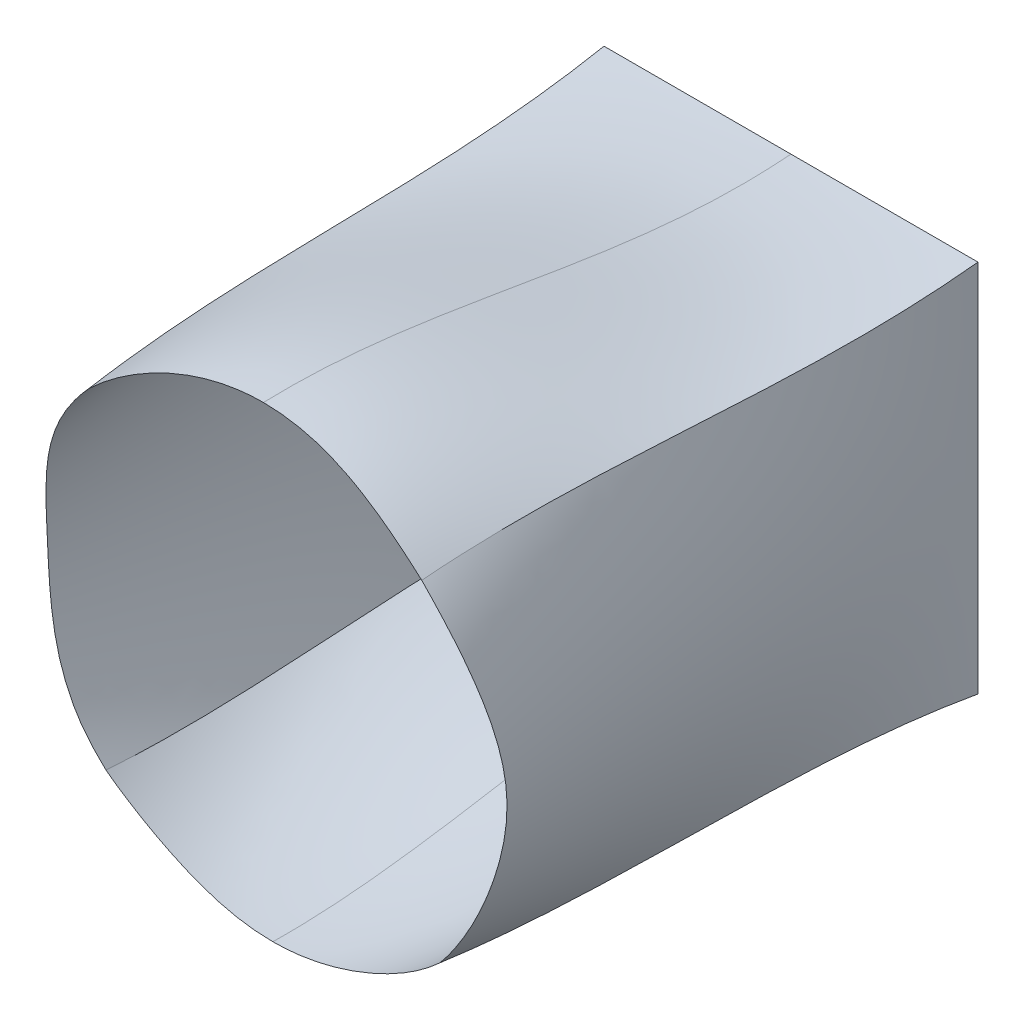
SolidWorks part; units mm, degrees
ref_plane "Front Plane" through (0, 0, 0) normal (0, 0, 1) x (1, 0, 0)
ref_plane "Top Plane" through (0, 0, 0) normal (0, 1, 0) x (1, 0, 0)
ref_plane "Right Plane" through (0, 0, 0) normal (1, 0, 0) x (0, 0, -1)
sketch "Sketch1" plane through (0, 0, 0) normal (0, 0, 1) x (1, 0, 0)
  line L1 (-50, 50) -> (50, 50)
  line L2 (-50, 50) -> (-50, -50)
  line L3 (-50, -50) -> (50, -50)
  line L4 (50, 50) -> (50, -50)
  line L5 (-50, 50) -> (50, -50) construction
  line L6 (-50, -50) -> (50, 50) construction
  point P0 (0, 0)
  dimension "D1" = 100
ref_plane "Plane2" through (0, 0, 150) normal (0, 0, 1) x (1, 0, 0)
sketch "Sketch2" plane through (0, 0, 150) normal (0, 0, 1) x (1, 0, 0)
  line L0 (-50, 50) -> (50, -50) construction
  circle A0 centre (0, 0) radius 62.5
  dimension "D1" = 125
sketch "Sketch3" plane through (0, 0, 0) normal (1, 0, 0) x (0, 0, -1)
  line L4 (0, 0) -> (-36.5278, 0) construction
  spline S0 degree 3 poles (0, 50) (-50.7313, 46.07) (-99.0745, 66.914) (-150, 62.5) knots 0 0 0 0 1 1 1 1
  spline S1 degree 3 poles (0, -50) (-50.7313, -46.07) (-99.0745, -66.914) (-150, -62.5) knots 0 0 0 0 1 1 1 1
surface "Surface-Loft1"
sketch "Sketch4" plane through (0, 0, 0) normal (1, 0, 0) x (0, 0, -1)
  spline S0 degree 3 poles (-137.7881, 71.3203) (-149.9856, 46.9565) (-131.7347, 10.2945) (-142.5728, -39.362) (-134.0789, -64.8996) (-146.3203, -75.477) knots 0 0 0 0 0.495379 0.744483 1 1 1 1
surface "Surface-Trim1"
sketch "Sketch5" plane through (0, 0, 0) normal (0, 1, 0) x (1, 0, 0)
  line L0 (0, 0) -> (0, -153.0258)
